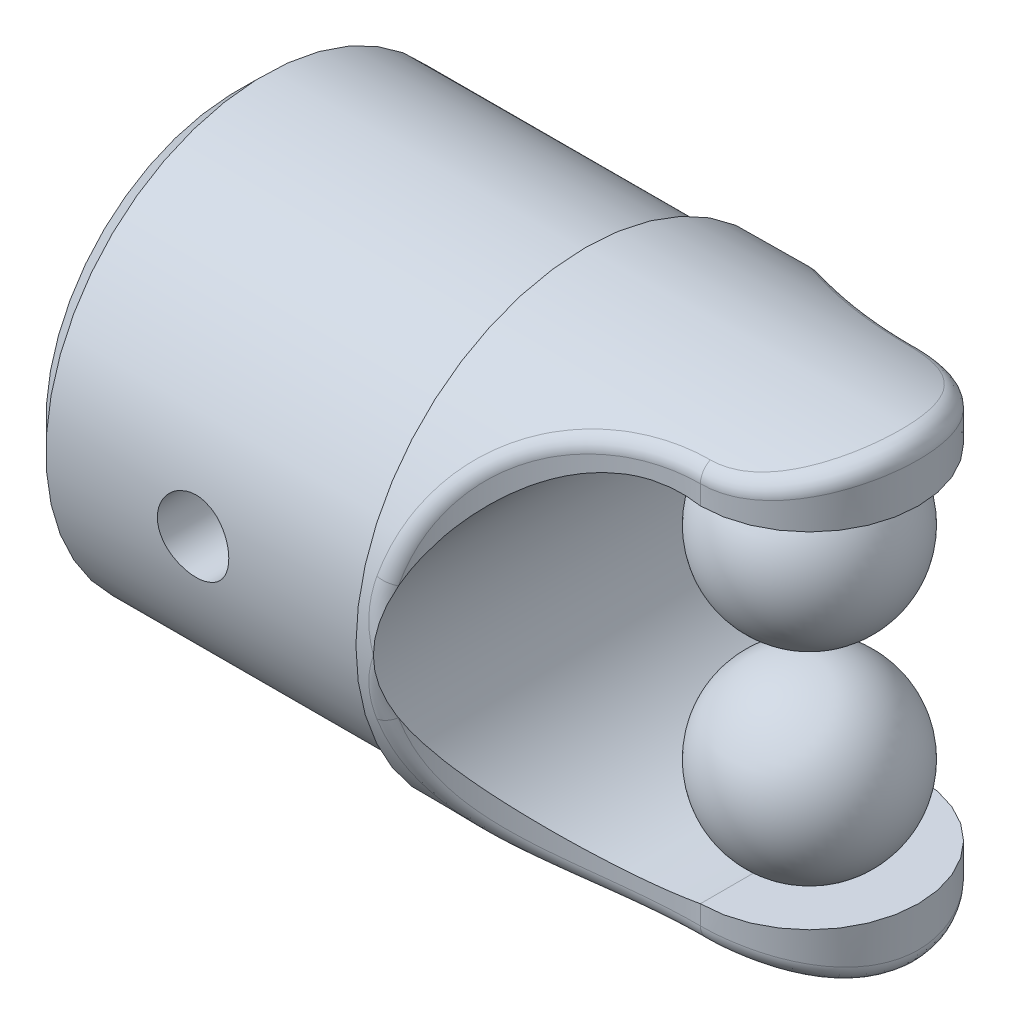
SolidWorks part; units mm, degrees
ref_plane "Front Plane" through (0, 0, 0) normal (0, 0, 1) x (1, 0, 0)
ref_plane "Top Plane" through (0, 0, 0) normal (0, 1, 0) x (1, 0, 0)
ref_plane "Right Plane" through (0, 0, 0) normal (1, 0, 0) x (0, 0, -1)
sketch "Sketch0" plane through (0, 0, 0) normal (0, 1, 0) x (1, 0, 0)
  line L0 (-25.019, 0) -> (25.019, 0) construction
  line L1 (-25.019, 9.525) -> (-25.019, -9.525) construction
  line L2 (-9.779, 5.5562) -> (-9.779, -5.5562) construction
  line L3 (-9.779, 5.5562) -> (-4.2228, 0) construction
  line L4 (-4.2228, 0) -> (-9.779, -5.5562) construction
  line L5 (-7.0009, 2.7781) -> (-7.0009, -2.7781) construction
  line L6 (0, 10.033) -> (0, -10.033) construction
  point P7 (-9.779, 0)
  point P8 (0, 0)
  point P12 (-7.0009, 0)
sketch "Sketch1" plane through (0, 0, 0) normal (0, 1, 0) x (1, 0, 0)
  line L0 (-9.779, 9.525) -> (-9.779, 10.033)
  line L1 (4.7625, 10.033) -> (4.7625, 0)
  line L2 (4.7625, 0) -> (-25.019, 0)
  line L3 (-25.019, 0) -> (-25.019, 9.525)
  line L4 (-25.019, 9.525) -> (-25.019, -9.525) construction
  line L5 (-25.019, 0) -> (25.019, 0) construction
  line L6 (-25.019, 9.525) -> (-9.779, 9.525)
  line L7 (-9.779, 10.033) -> (4.7625, 10.033)
  line L11 (0, 0) -> (9.525, 0) construction
  line L12 (-9.779, 5.5562) -> (-9.779, -5.5562) construction
  circle A0 centre (0, 0) radius 9.525 construction
revolve "Revolve1" add sketch "Sketch1" angle 360 about L0
chamfer "Chamfer1" distance 1.1906 angle 45 1 edges at (-25.019, 0, 9.525)
sketch "Sketch2" plane through (0, 0, 0) normal (0, 1, 0) x (1, 0, 0)
  line L0 (-9.779, 10.033) -> (-9.017, 10.033) construction
  line L1 (4.7625, 10.033) -> (-9.779, 10.033) construction
  line L2 (-9.779, 9.525) -> (-9.779, 10.033) construction
  line L4 (-25.019, 0) -> (4.7625, 0) construction
  line L5 (-9.017, 10.033) -> (9.525, 10.033)
  line L6 (9.525, 10.033) -> (9.525, -10.033)
  line L7 (9.525, -10.033) -> (-9.017, -10.033)
  line L8 (0, 4.7625) -> (0, 0) construction
  arc A0 (-9.017, 10.033) -> (0, 4.7625) centre (0, 15.1111) ccw
  arc A1 (0, -4.7625) -> (0, 4.7625) centre (0, 0) ccw
  arc A2 (-9.017, -10.033) -> (0, -4.7625) centre (0, -15.1111) cw
  dimension "D1" = 9.525
  dimension "D2" = 0.762
extrude "Extrude1" cut sketch "Sketch2" against normal through all and the other way through all
sketch "Sketch3" plane through (0, 0, 0) normal (0, 0, 1) x (1, 0, 0)
  line L0 (0, 7.5248) -> (4.7625, 7.5248)
  line L1 (4.7625, 7.5248) -> (4.7625, -7.5248)
  line L2 (4.7625, -10.033) -> (4.7625, 10.033) construction
  line L3 (0, -7.5248) -> (4.7625, -7.5248)
  line L4 (0, -8.8306) -> (0, 8.8306) construction
  line L5 (0, 0) -> (4.7625, 0) construction
  arc A0 (0, 7.5248) -> (0, -7.5248) centre (-1.3688, 0) ccw
  spline S0 degree 3 poles (0, -8.8306) (-0.6647, -8.8306) (-1.3176, -8.7972) (-2.6002, -8.657) (-3.2355, -8.5479) (-4.4201, -8.239) (-4.9765, -8.0393) (-6.0117, -7.5104) (-6.4669, -7.1925) (-7.0654, -6.6183) (-7.2517, -6.4093) (-7.5928, -5.9608) (-7.746, -5.7239) (-8.0224, -5.2246) (-8.1456, -4.9622) (-8.3656, -4.4114) (-8.4625, -4.1218) (-8.7121, -3.2362) (-8.8275, -2.6171) (-8.981, -1.3227) (-9.0166, -0.6678) (-9.0172, 0.3188) (-9.0083, 0.6499) (-8.9714, 1.3096) (-8.9436, 1.6344) (-8.8685, 2.2738) (-8.8211, 2.5884) (-8.7038, 3.2074) (-8.6335, 3.5131) (-8.3838, 4.4049) (-8.1707, 4.9521) (-7.7585, 5.7036) (-7.6043, 5.944) (-7.265, 6.3934) (-7.0814, 6.6011) (-6.6843, 6.9855) (-6.4709, 7.1621) (-6.0124, 7.4867) (-5.7658, 7.6351) (-4.9969, 8.0306) (-4.4406, 8.2329) (-3.2406, 8.5473) (-2.6168, 8.6546) (-1.3307, 8.7964) (-0.6652, 8.8306) (0, 8.8306) knots 0 0 0 0 0.0625 0.0625 0.125 0.125 0.1875 0.1875 0.25 0.25 0.28125 0.28125 0.3125 0.3125 0.34375 0.34375 0.375 0.375 0.4375 0.4375 0.5 0.5 0.53125 0.53125 0.5625 0.5625 0.59375 0.59375 0.625 0.625 0.6875 0.6875 0.71875 0.71875 0.75 0.75 0.78125 0.78125 0.8125 0.8125 0.875 0.875 0.9375 0.9375 1 1 1 1 construction
extrude "Extrude3" cut sketch "Sketch3" against normal through all and the other way through all
sketch "Sketch4" plane through (-25.019, 0, 0) normal (-1, 0, 0) x (0, 0, 1)
  circle A0 centre (0, 0) radius 5.5562
extrude "Extrude4" cut sketch "Sketch4" against normal up to vertex
sketch "Sketch23" plane through (0, 0, 0) normal (0, 0, 1) x (1, 0, 0)
  line L0 (-25.019, 8.3344) -> (-25.019, -8.3344) construction
  circle A0 centre (-17.399, 0) radius 1.5602
extrude "Cut-Extrude1" cut sketch "Sketch23" along normal through all
sketch "Sketch19" plane through (0, 0, 0) normal (0, 0, 1) x (1, 0, 0)
  line L0 (0, 8.3608) -> (0, -8.3608) construction
  line L1 (4.7625, 7.5247) -> (4.7625, 10.033) construction
  line L2 (0, 0.508) -> (0, 8.3608)
  line L3 (4.7625, 10.033) -> (-9.779, 10.033) construction
  line L4 (0, -0.508) -> (0, -8.3608)
  arc A1 (0, 8.3608) -> (0, 0.508) centre (0, 4.4344) ccw
  arc A2 (0, -8.3608) -> (0, -0.508) centre (0, -4.4344) cw
revolve "Cut-Revolve1" cut sketch "Sketch19" angle 360 about L0
sketch "Sketch21" plane through (0, 0, 0) normal (0, 0, 1) x (1, 0, 0)
  line L1 (0, -8.3608) -> (0, -0.508)
  line L2 (0, -8.3608) -> (0, -0.508)
  line L3 (0, 0.508) -> (0, 8.3608)
  line L4 (0, 0.508) -> (0, 8.3608)
  arc A1 (0, -0.508) -> (0, -8.3608) centre (0, -4.4344) ccw
  arc A2 (0, -0.508) -> (0, -8.3608) centre (0, -4.4344) ccw
  arc A3 (0, 8.3608) -> (0, 0.508) centre (0, 4.4344) ccw
  arc A4 (0, 8.3608) -> (0, 0.508) centre (0, 4.4344) ccw
  dimension "D1" = 0
  dimension "D2" = 0
revolve "Revolve3" add sketch "Sketch21" angle 360 about L4
fillet "Fillet5" radius 0.762 6 edges at (4.7526, -10.0283, 0.3066) (4.7526, 10.0283, -0.3066) (-7.3396, -6.291, 7.8157) (-5.9029, 7.5468, 6.6111) (-7.3396, 6.291, -7.8157) (-5.9029, -7.5468, -6.6111)
mirror "Mirror1" [suppressed] about plane through (0, 0, 0) normal (1, 0, 0)
move or copy body "Body-Move/Copy1" [suppressed] bodies to move or copy 110 149 148 copy no rotation origin (0, 0, 0) rotation axis (1, 0, 0) rotation angle 90
sketch "Sketch18" plane through (0, 0, 0) normal (0, 1, 0) x (1, 0, 0)
  line L0 (-25.019, -5.5563) -> (-9.779, -5.5562)
  line L3 (-25.019, 5.5563) -> (-9.779, 5.5562)
  line L4 (-9.779, 5.5562) -> (-9.779, -5.5562)
  line L6 (9.779, -5.5562) -> (25.019, -5.5562)
  line L7 (9.779, 5.5562) -> (25.019, 5.5562)
  line L12 (-25.019, 9.525) -> (-25.019, -9.525) construction
  line L13 (-9.779, 5.5562) -> (-9.779, -5.5562) construction
  line L14 (9.779, 5.5562) -> (9.779, -5.5562)
sketch "Sketch22" plane through (0, 0, 0) normal (0, 0, 1) x (1, 0, 0)
  line L0 (-3.9264, -3.9264) -> (3.9264, 3.9264) construction
  line L1 (-3.9264, 3.9264) -> (3.9264, 3.9264)
  line L2 (-3.9264, 3.9264) -> (-3.9264, -3.9264)
  line L3 (-3.9264, -3.9264) -> (3.9264, -3.9264)
  line L4 (3.9264, 3.9264) -> (3.9264, -3.9264)
  circle A0 centre (0, 4.4344) radius 3.9264 construction
extrude "Boss-Extrude1" [suppressed] add sketch "Sketch22" along normal mid plane 8.8688
move or copy body "Body-Move/Copy2" [suppressed] bodies to move or copy 111 copy no rotation origin (0, 0, 0) rotation axis (0, 0, -1) rotation angle 45
equation "\"D1@Chamfer1\" = \"OD@Sketch0\"/16"
equation "\"D2@Sketch1\" = \"D1@Sketch1\"*.5"
equation "\"D2@Sketch19\" = \"D1@Sketch19\"/3"
equation "\"D1@Sketch3\" = \"D1@Sketch0\"*.750"
equation "\"D1@Boss-Extrude1\" = \"D4@Sketch19\""
equation "\"D2@Sketch23\" = \"Bore Dp@Sketch0\"/2"
